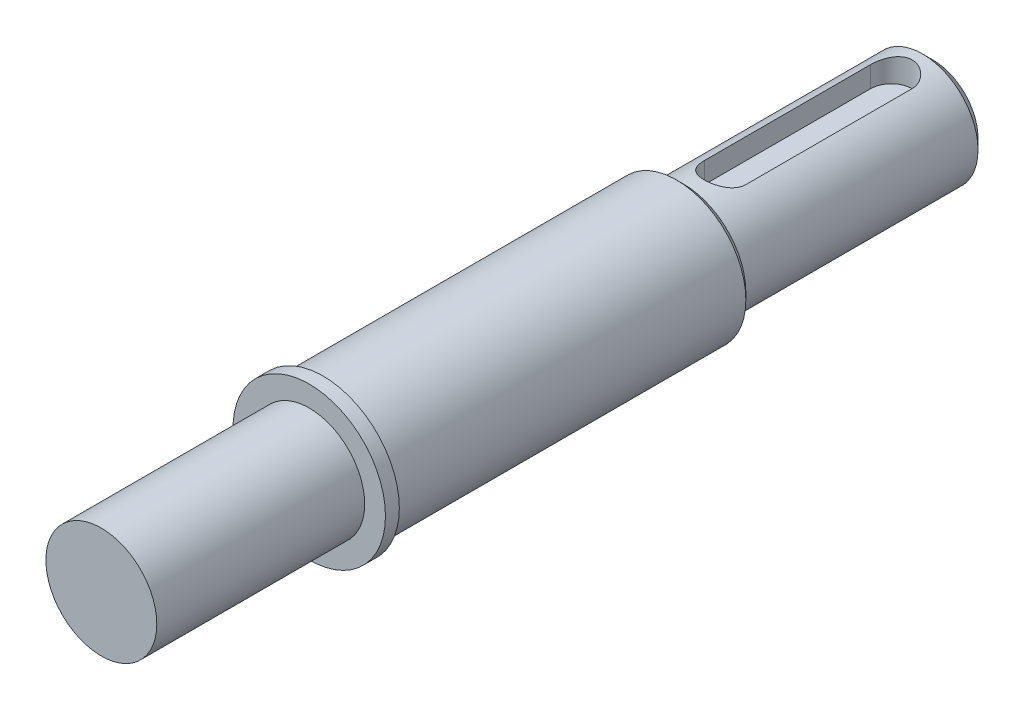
SolidWorks part; units mm, degrees
ref_plane "Face" through (0, 0, 0) normal (0, 0, 1) x (1, 0, 0)
ref_plane "Dessus" through (0, 0, 0) normal (0, 1, 0) x (1, 0, 0)
ref_plane "Droite" through (0, 0, 0) normal (1, 0, 0) x (0, 0, -1)
sketch "Esquisse1" plane through (0, 0, 0) normal (0, 0, 1) x (1, 0, 0)
  circle A0 centre (0, 0) radius 4
  dimension "D1" = 8
extrude "Extrusion1" add sketch "Esquisse1" along normal blind 60
ref_plane "Plan1" through (0, 2.2, 0) normal (0, 1, 0) x (-1, 0, 0)
sketch "Esquisse2" plane through (0, 2.2, 0) normal (0, 1, 0) x (1, 0, 0)
  line L0 (0, 0) -> (0, -48.6984) construction
  line L2 (-1.5, -3) -> (-1.5, -15)
  line L4 (1.5, -3) -> (1.5, -15)
  arc A0 (-1.5, -3) -> (1.5, -3) centre (0, -3) cw
  arc A1 (-1.5, -15) -> (1.5, -15) centre (0, -15) ccw
  dimension "D1" = 12
  dimension "D2" = 3
  dimension "D3" = 3
extrude "Enlèv. mat.-Extru.1" cut sketch "Esquisse2" along normal through all
chamfer "Chanfrein1" distance 0.75 angle 45 1 edges at (4, 0, 0)
sketch "Esquisse3" plane through (0, 0, 60) normal (0, 0, 1) x (1, 0, 0)
  circle A0 centre (0, 0) radius 3
  dimension "D1" = 6
extrude "Enlèv. mat.-Extru.2" cut sketch "Esquisse3" against normal blind 15 flip side to cut
ref_plane "Plan2" through (0, 0, 25.35) normal (0, 0, 1) x (1, 0, 0)
sketch "Esquisse7" plane through (0, 0, 45) normal (0, 0, 1) x (1, 0, 0)
  circle A0 centre (0, 0) radius 5.5
  dimension "D1" = 11
extrude "Extrusion4" add sketch "Esquisse7" against normal blind 1
sketch "Esquisse8" plane through (0, 0, 44) normal (0, 0, -1) x (-1, 0, 0)
  circle A0 centre (0, 0) radius 5
  dimension "D1" = 10
extrude "Extrusion5" add sketch "Esquisse8" along normal blind 26
chamfer "Chanfrein2" distance 0.5 angle 45 1 edges at (-5, 0, 18)
sketch "Esquisse9" plane through (0, 0, 60) normal (0, 0, 1) x (1, 0, 0)
  circle A0 centre (0, 0) radius 4
  dimension "D1" = 8
extrude "Extrusion6" add sketch "Esquisse9" against normal up to surface (15 mm away)
